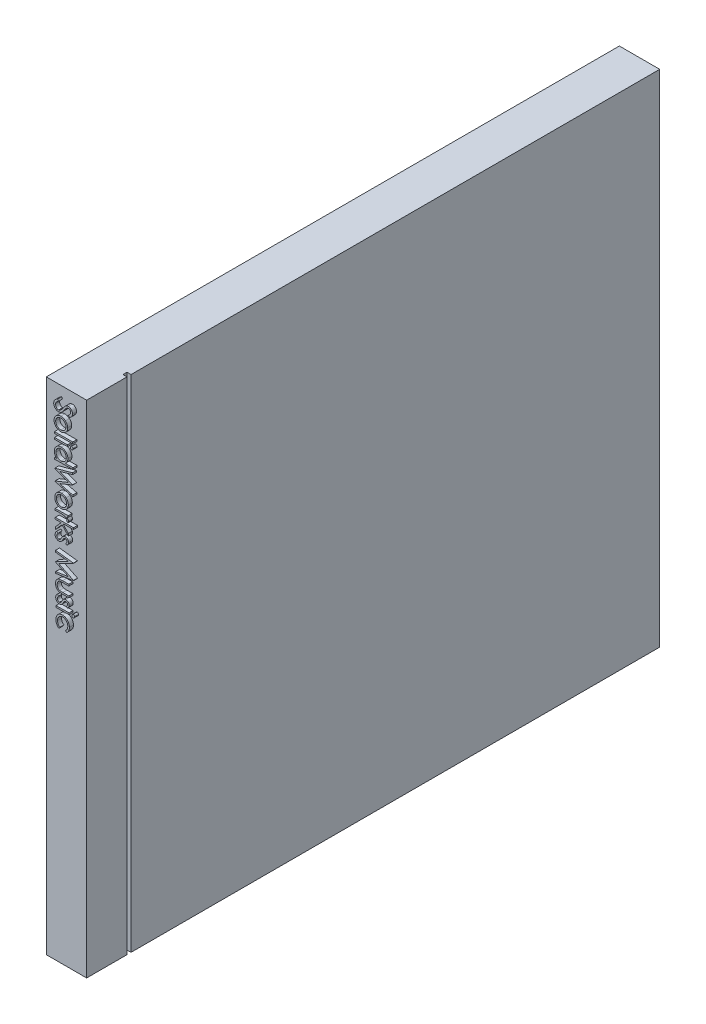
SolidWorks part; units mm, degrees
ref_plane "Plane1" through (0, 0, 0) normal (0, 0, 1) x (1, 0, 0)
ref_plane "Plane2" through (0, 0, 0) normal (0, 1, 0) x (1, 0, 0)
ref_plane "Plane3" through (0, 0, 0) normal (1, 0, 0) x (0, 0, -1)
sketch "Sketch1" plane through (0, 0, 0) normal (1, 0, 0) x (0, 0, -1)
  line L1 (0, 0) -> (142, 0)
  line L2 (0, 0) -> (0, 124)
  line L3 (0, 124) -> (142, 124)
  line L4 (142, 0) -> (142, 124)
  dimension "D1" = 142
  dimension "D2" = 124
extrude "Base-Extrude" add sketch "Sketch1" along normal blind 10
sketch "Sketch2" plane through (0, 11.766, 0) normal (0, 0, 1) x (0.0105, -0.9999, 0)
  text T0 "SolidWorks Music" font "Century Gothic" height 1
extrude "Boss-Extrude1" add sketch "Sketch2" along normal blind 1
sketch "Sketch3" plane through (10, 0, 0) normal (1, 0, 0) x (0, 0, -1)
  line L0 (142, 124) -> (0, 124) construction
  line L1 (10, 124) -> (11, 124)
  line L2 (10, 124) -> (10, 0)
  line L3 (10, 0) -> (11, 0)
  line L4 (11, 124) -> (11, 0)
  line L5 (0, 0) -> (142, 0) construction
  line L6 (0, 124) -> (0, 0) construction
  dimension "D1" = 1
  dimension "D2" = 10
extrude "Cut-Extrude1" cut sketch "Sketch3" against normal blind 1
